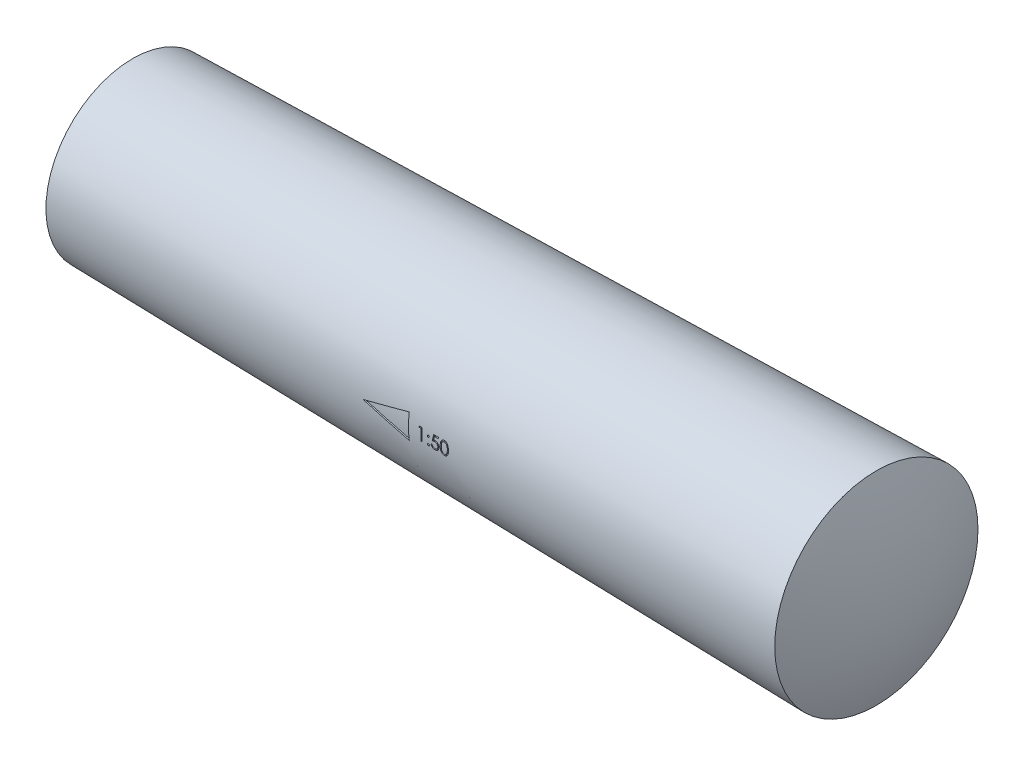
SolidWorks part; units mm, degrees
ref_plane "Front Plane" through (0, 0, 0) normal (0, 0, 1) x (1, 0, 0)
ref_plane "Top Plane" through (0, 0, 0) normal (0, 1, 0) x (1, 0, 0)
ref_plane "Right Plane" through (0, 0, 0) normal (1, 0, 0) x (0, 0, -1)
sketch "Sketch1" plane through (0, 0, 0) normal (1, 0, 0) x (0, 0, -1)
  circle A0 centre (0, 0) radius 7
  dimension "D1" = 14
extrude "Extrude1" add sketch "Sketch1" along normal mid plane 60
draft "Draft1" type of draft neutral plane draft angle 1.146 faces to draft 1 parameters "D1"=1.146
sketch "Sketch2" plane through (0, 0, 0) normal (0, 0, 1) x (1, 0, 0)
  line L0 (-30, 0) -> (-30, 7)
  line L1 (-30, 7) -> (-30, -7) construction
  line L2 (-30, 0) -> (-31.6, 0)
  line L3 (-31.6, 0) -> (-31.6, -7.6) construction
  line L4 (30, 0) -> (30, 8.2)
  line L5 (30, -8.2) -> (30, 8.2) construction
  line L6 (30, 0) -> (31.6, 0)
  line L7 (31.6, 0) -> (31.6, -7.6) construction
  line L8 (-30, -7) -> (30, -8.2) construction
  arc A0 (-31.6, 0) -> (-30, 7) centre (-15.4875, 0) cw
  arc A1 (31.6, 0) -> (30, 8.2) centre (9.7873, 0) ccw
  point P14 (0, -7.6)
revolve "Revolve1" add sketch "Sketch2" angle 360 about L2
sketch "Sketch5" plane through (0, 0, 0) normal (0, 0, 1) x (1, 0, 0)
  line L0 (0, 7.6) -> (0, -7.6) construction
  line L1 (30, 8.2) -> (-30, 7) construction
  line L2 (-30, -7) -> (30, -8.2) construction
ref_plane "Plane2" through (0, 0, 0) normal (-0.02, 0, 0.9998) x (0.9998, 0, 0.02)
sketch "Sketch6" plane through (0, 0, 0) normal (-0.02, 0, 0.9998) x (0.9998, 0, 0.02)
  line L0 (0, 0) -> (0, 1)
  line L1 (0, 7.6) -> (0, -7.6) construction
  line L2 (0, 1) -> (-3.7321, 0)
  line L3 (-3.7321, 0) -> (0, -1)
  line L4 (0, -1) -> (0, 0)
  line L5 (0, -0.5) -> (4, -0.5) construction
  text T0 "1:50" font "Century Gothic" height 1
  dimension "D1" = 2
  dimension "D2" = 30
  dimension "D3" = 4
wrap "Wrap2" sketch "Sketch6" wrap type deboss source sketch "Sketch6" thickness 0.1 parameters "D1"=0.1
equation "\"D2@Sketch2\" = \"D1@Sketch2\""
